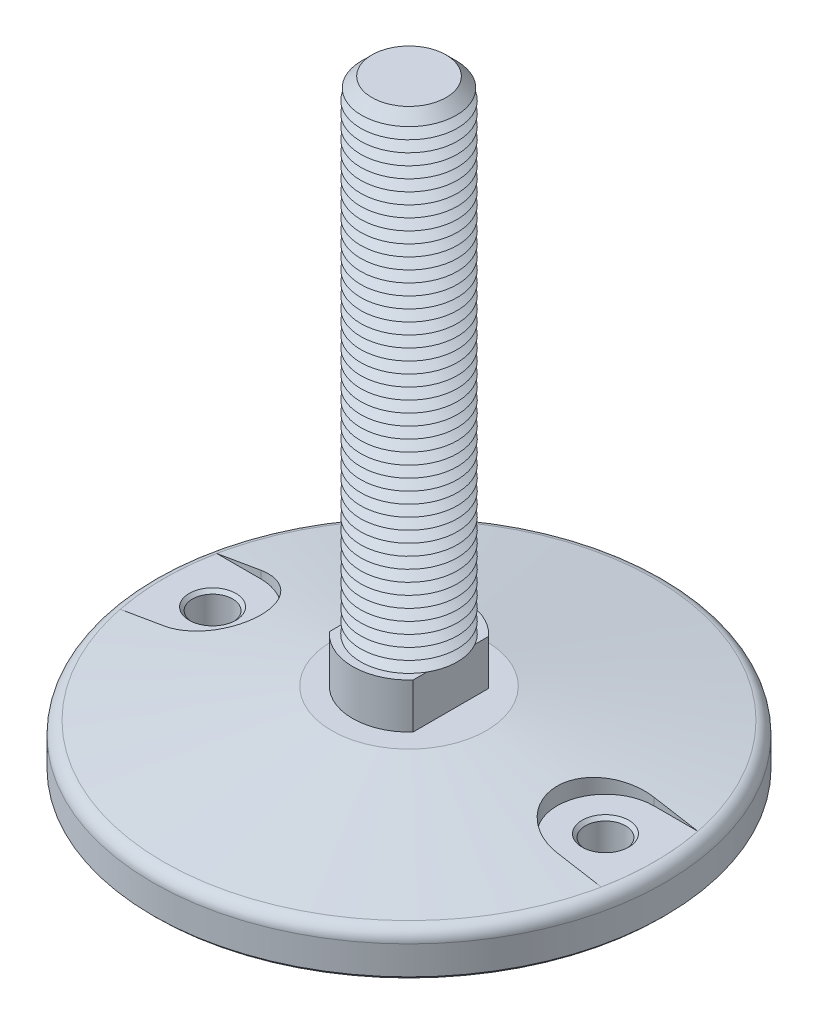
SolidWorks part; units mm, degrees
ref_plane "Front Plane" through (0, 0, 0) normal (0, 0, 1) x (1, 0, 0)
ref_plane "Top Plane" through (0, 0, 0) normal (0, 1, 0) x (1, 0, 0)
ref_plane "Right Plane" through (0, 0, 0) normal (1, 0, 0) x (0, 0, -1)
sketch "Sketch1" plane through (0, 0, 0) normal (1, 0, 0) x (0, 0, -1)
  line L0 (0, 61.3389) -> (0, -58.404) construction
sketch "Sketch2" plane through (0, 0, 0) normal (1, 0, 0) x (0, 0, -1)
  line L0 (0, 0) -> (-24, 0)
  line L1 (-24, 0) -> (-79.5, -9.7861)
  line L2 (-79.5, -9.7861) -> (-79.5, -23)
  line L3 (-79.5, -23) -> (0, -23)
  line L4 (0, 61.3389) -> (0, -58.404) construction
  line L5 (0, -23) -> (0, 0)
  dimension "D1" = 23
  dimension "D2" = 79.5
  dimension "D3" = 24
  dimension "D4" = 10
revolve "Revolve1" add sketch "Sketch2" angle 360 about L0
fillet "Fillet1" radius 4 1 edges at (0, -9.7861, 79.5)
sketch "Sketch3" plane through (0, 0, 0) normal (0, 1, 0) x (1, 0, 0)
  circle A0 centre (0, 0) radius 17.5
  dimension "D1" = 35
extrude "Boss-Extrude1" add sketch "Sketch3" along normal blind 14
sketch "Sketch4" plane through (0, 14, 0) normal (0, 1, 0) x (1, 0, 0)
  line L0 (-13, 11.7154) -> (-13, -11.7154)
  line L2 (13, -11.7154) -> (13, 11.7154)
  arc A0 (-13, 11.7154) -> (-13, -11.7154) centre (0, 0) ccw
  circle A1 centre (0, 0) radius 17.5 construction
  arc A2 (13, -11.7154) -> (13, 11.7154) centre (0, 0) ccw
  dimension "D1" = 26
extrude "Cut-Extrude1" cut sketch "Sketch4" against normal blind 14
sketch "Sketch5" plane through (0, 14, 0) normal (0, 1, 0) x (1, 0, 0)
  circle A0 centre (0, 0) radius 15
  dimension "D1" = 30
extrude "Boss-Extrude2" add sketch "Sketch5" along normal blind 150
chamfer "Chamfer1" distance 3.5 angle 45 1 edges at (0, 164, 15)
sketch "Sketch6" plane through (0, 0, 0) normal (1, 0, 0) x (0, 0, -1)
  line L0 (-15, 14) -> (-11.9689, 15.75)
  line L1 (-11.9689, 15.75) -> (-15, 17.5)
  line L2 (-15, 160.5) -> (-15, 14) construction
  line L3 (-15, 17.5) -> (-15, 14)
  dimension "D1" = 3.5
revolve "Cut-Revolve1" cut sketch "Sketch6" angle 360 about L0
pattern_linear "LPattern1" count 42 spacing 3.5 along (0, 1, 0) of "Cut-Revolve1"
sketch "Sketch8" plane through (0, 0, 0) normal (0, 1, 0) x (1, 0, 0)
  line L0 (-61, 15) -> (-74.7035, 15)
  line L1 (-61, -15) -> (-74.7035, -15)
  arc A1 (-74.7035, 15) -> (-74.7035, -15) centre (0, 0) ccw
  circle A2 centre (0, 0) radius 76.1946 construction
  arc A3 (-61, -15) -> (-61, 15) centre (-61, 0) ccw
  point P3 (-61, 0)
  point P11 (0, 0)
  dimension "D1" = 61
  dimension "D2" = 30
extrude "Cut-Extrude4" cut sketch "Sketch8" against normal blind 9.2
sketch "Sketch10" plane through (0, -9.2, 0) normal (0, 1, 0) x (1, 0, 0)
  circle A0 centre (-61, 0) radius 6.25
  dimension "D1" = 12.5
extrude "Cut-Extrude5" cut sketch "Sketch10" against normal up to surface (13.8 mm away)
chamfer "Chamfer2" distance 1 angle 45 2 edges at (-61, -23, -6.25) (-61, -9.2, 6.25)
mirror "Mirror1" about plane through (0, 0, 0) normal (1, 0, 0) of "Chamfer2", "Cut-Extrude5", "Cut-Extrude4"
chamfer "Chamfer3" distance 1 angle 45 1 edges at (0, -23, 79.5)
